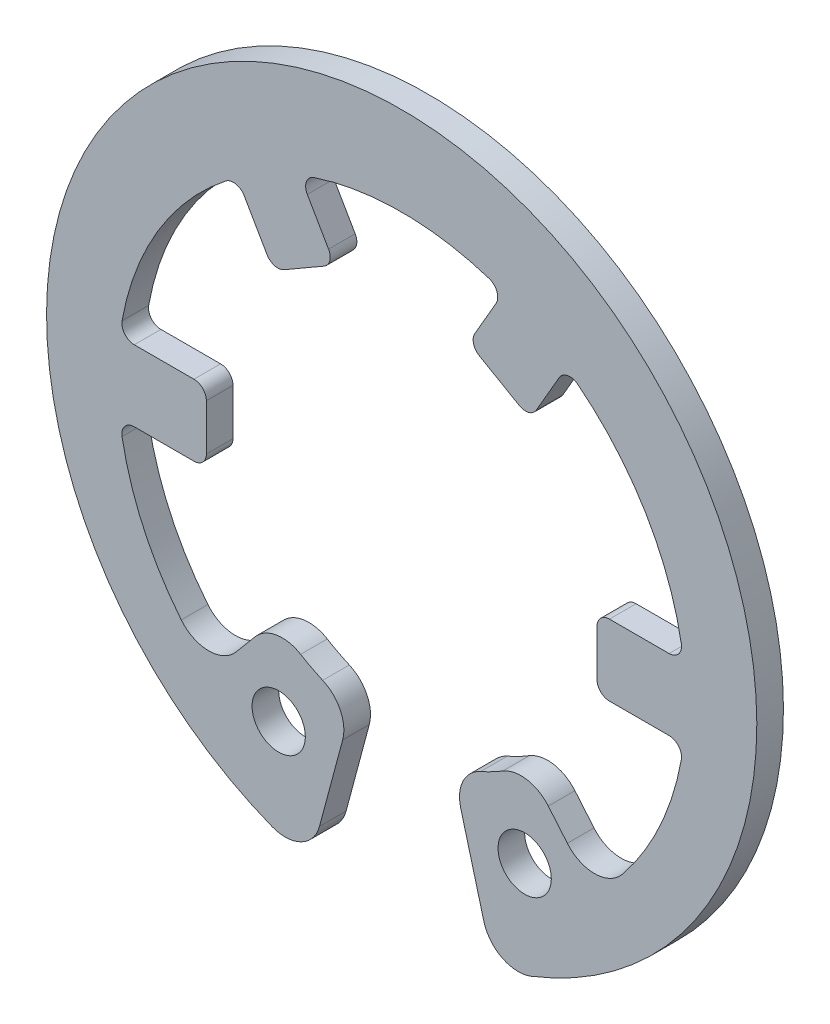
SolidWorks part; units mm, degrees
ref_plane "Plan1" through (0, 0, 0) normal (0, 0, 1) x (1, 0, 0)
ref_plane "Plan2" through (0, 0, 0) normal (0, 1, 0) x (1, 0, 0)
ref_plane "Plan3" through (0, 0, 0) normal (1, 0, 0) x (0, 0, -1)
sketch "Esquisse1" plane through (0, 0, 0) normal (0, 0, 1) x (1, 0, 0)
  line L0 (0, 0) -> (-7.0711, 12.2474) construction
  line L1 (-7.5299, 0.5) -> (-5.85, 0.5)
  line L2 (-2.3149, -8.6395) -> (-1.6623, -6.2038)
  line L3 (2.3149, -8.6395) -> (1.6623, -6.2038)
  line L4 (4.1284, -4.92) -> (4.6648, -5.5593)
  line L5 (-4.1284, -4.92) -> (-4.6648, -5.5593)
  line L6 (0, 0) -> (7.0711, 12.2474) construction
  line L7 (-7.5299, -1.5) -> (-5.85, -1.5)
  line L8 (-5.5, 0.15) -> (-5.5, -1.15)
  line L9 (7.5299, 0.5) -> (5.85, 0.5)
  line L10 (0, 0) -> (20, 0) construction
  line L11 (7.5299, -1.5) -> (5.85, -1.5)
  line L12 (5.5, 0.15) -> (5.5, -1.15)
  line L14 (-4.4348, 5.6812) -> (-3.791, 4.5662)
  line L15 (-2.6579, 6.6036) -> (-2.059, 5.5662)
  line L16 (-3.3129, 4.4381) -> (-2.1871, 5.0881)
  line L18 (2.6579, 6.6036) -> (2.059, 5.5662)
  line L19 (4.4348, 5.6812) -> (3.791, 4.5662)
  line L20 (2.1871, 5.0881) -> (3.3129, 4.4381)
  arc A0 (3.6454, -9.3119) -> (-3.6454, -9.3119) centre (0, 0) ccw
  arc A1 (6.2067, -5.5475) -> (7.8744, -1.9118) centre (0, -0.5) ccw
  arc A2 (1.4235, -5.3126) -> (-1.4235, -5.3126) centre (0, 0) ccw construction
  arc A3 (7.8744, 0.9118) -> (4.9546, 5.781) centre (0, -0.5) ccw
  arc A4 (-7.8744, -1.9118) -> (-6.2067, -5.5475) centre (0, -0.5) ccw
  arc A5 (-4.9546, 5.781) -> (-7.8744, 0.9118) centre (0, -0.5) ccw
  arc A6 (2.4625, 7.1116) -> (-2.4625, 7.1116) centre (0, -0.5) ccw
  arc A7 (-4.9546, 5.781) -> (-4.4348, 5.6812) centre (-4.7379, 5.5062) cw
  arc A8 (-3.3129, 4.4381) -> (-3.791, 4.5662) centre (-3.4879, 4.7412) cw
  arc A9 (-2.1871, 5.0881) -> (-2.059, 5.5662) centre (-2.3621, 5.3912) ccw
  arc A10 (-2.6579, 6.6036) -> (-2.4625, 7.1116) centre (-2.3548, 6.7786) cw
  arc A11 (2.4625, 7.1116) -> (2.6579, 6.6036) centre (2.3548, 6.7786) cw
  arc A12 (4.4348, 5.6812) -> (4.9546, 5.781) centre (4.7379, 5.5062) cw
  arc A13 (7.8744, 0.9118) -> (7.5299, 0.5) centre (7.5299, 0.85) cw
  arc A14 (7.8744, -1.9118) -> (7.5299, -1.5) centre (7.5299, -1.85) ccw
  arc A15 (5.5, 0.15) -> (5.85, 0.5) centre (5.85, 0.15) cw
  arc A16 (5.5, -1.15) -> (5.85, -1.5) centre (5.85, -1.15) ccw
  arc A17 (-5.5, -1.15) -> (-5.85, -1.5) centre (-5.85, -1.15) cw
  arc A18 (-5.5, 0.15) -> (-5.85, 0.5) centre (-5.85, 0.15) ccw
  arc A19 (-7.8744, 0.9118) -> (-7.5299, 0.5) centre (-7.5299, 0.85) ccw
  arc A20 (-7.8744, -1.9118) -> (-7.5299, -1.5) centre (-7.5299, -1.85) cw
  arc A21 (2.1871, 5.0881) -> (2.059, 5.5662) centre (2.3621, 5.3912) cw
  arc A22 (3.3129, 4.4381) -> (3.791, 4.5662) centre (3.4879, 4.7412) ccw
  arc A23 (-2.8451, -4.707) -> (-2.2239, -5.0303) centre (0, 0) ccw
  arc A24 (2.8451, -4.707) -> (2.2239, -5.0303) centre (0, 0) cw
  arc A25 (-6.2067, -5.5475) -> (-4.6648, -5.5593) centre (-5.4309, -4.9165) ccw
  arc A26 (-2.8451, -4.707) -> (-4.1284, -4.92) centre (-3.3623, -5.5628) ccw
  arc A27 (-2.2239, -5.0303) -> (-1.6623, -6.2038) centre (-2.6282, -5.945) cw
  arc A28 (-3.6454, -9.3119) -> (-2.3149, -8.6395) centre (-3.2809, -8.3807) ccw
  arc A29 (3.6454, -9.3119) -> (2.3149, -8.6395) centre (3.2809, -8.3807) cw
  arc A30 (2.2239, -5.0303) -> (1.6623, -6.2038) centre (2.6282, -5.945) ccw
  arc A31 (2.8451, -4.707) -> (4.1284, -4.92) centre (3.3623, -5.5628) cw
  arc A32 (6.2067, -5.5475) -> (4.6648, -5.5593) centre (5.4309, -4.9165) cw
  point P22 (-2.75, 4.7631)
  point P29 (2.75, 4.7631)
  point P35 (-4.6319, 6.0227)
  point P38 (-3.616, 4.2631)
  point P41 (-1.884, 5.2631)
  point P46 (2.8683, 6.9681)
  point P51 (7.9373, 0.5)
  point P54 (7.9373, -1.5)
  point P65 (-7.9373, 0.5)
  point P68 (-7.9373, -1.5)
  point P71 (1.884, 5.2631)
  point P74 (3.616, 4.2631)
  point P76 (-5.3844, -6.4168)
  point P79 (-3.5353, -4.2132)
  point P85 (-2.5882, -9.6593)
  point P88 (2.5882, -9.6593)
  point P94 (3.5353, -4.2132)
  point P97 (5.3844, -6.4168)
  dimension "D1" = 20
  dimension "D2" = 16
  dimension "D5" = 11
  dimension "D13" = 0.35
  dimension "D14" = 1
  dimension "D3" = 0.5
  dimension "D4" = 30
  dimension "D6" = 80
  dimension "D7" = 2
  dimension "D8" = 2
  dimension "D9" = 60
  dimension "D10" = 60
  dimension "D11" = 2
  dimension "D12" = 2
extrude "Base-Extrusion" add sketch "Esquisse1" along normal blind 0.75
sketch "Esquisse2" plane through (0, 0, 0.75) normal (0, 0, 1) x (1, 0, 0)
  line L0 (0, 0) -> (-3.4631, -6.6526) construction
  line L1 (0, 0) -> (3.4631, -6.6526) construction
  circle A0 centre (0, 0) radius 7.5 construction
  circle A1 centre (-3.4631, -6.6526) radius 0.75
  circle A2 centre (3.4631, -6.6526) radius 0.75
  dimension "D1" = 15
  dimension "D3" = 1.5
  dimension "D4" = 1.5
  dimension "D2" = 55
extrude "Enlèv. mat.-Extru.1" cut sketch "Esquisse2" against normal through all
